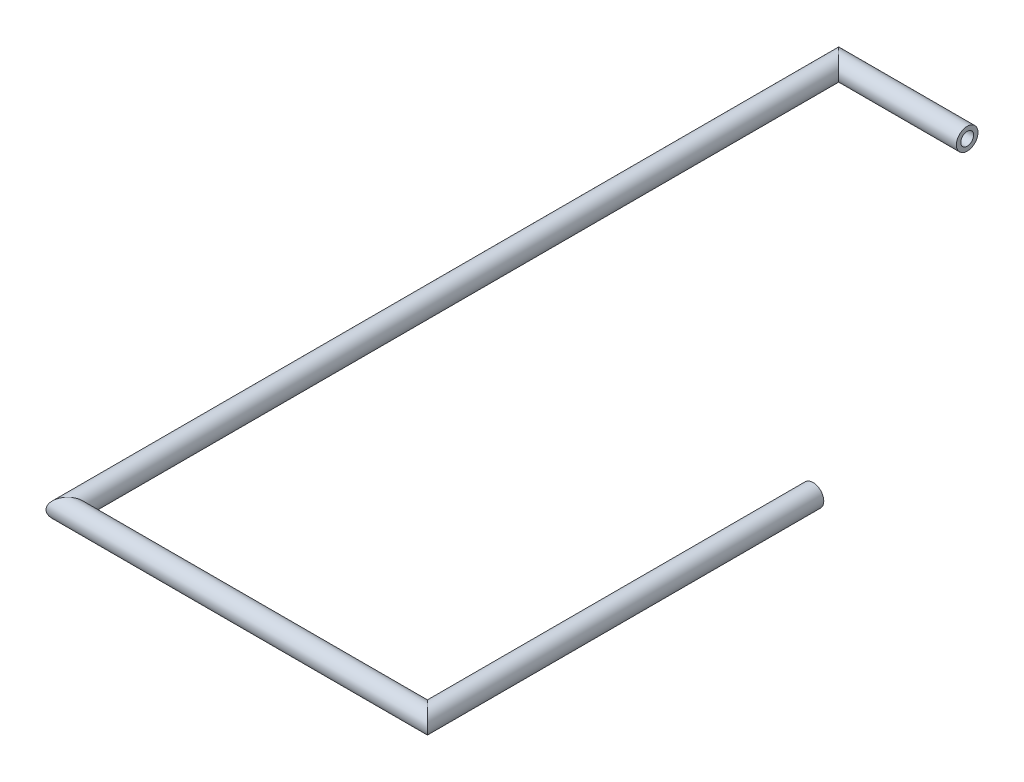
SolidWorks part; units mm, degrees
ref_plane "Front Plane" through (0, 0, 0) normal (0, 0, 1) x (1, 0, 0)
ref_plane "Top Plane" through (0, 0, 0) normal (0, 1, 0) x (1, 0, 0)
ref_plane "Right Plane" through (0, 0, 0) normal (1, 0, 0) x (0, 0, -1)
sketch "Sketch2" plane through (0, 2165.865, 0) normal (0, 1, 0) x (1, 0, 0)
  line L0 (0, 0) -> (0, -381)
  line L1 (0, -381) -> (-355.6, -381)
  line L2 (-355.6, -381) -> (-355.6, 381)
  line L3 (-355.6, 381) -> (-228.6, 381)
  point P2 (398.0429, 151.297)
  point P3 (0, 0)
  point P4 (0, 0)
  point P5 (0, 0)
  point P8 (0, 0)
  point P12 (0, 0)
  point P13 (0, 0)
  point P14 (0, 0)
  point P15 (969.2528, -1732.4212)
  point P16 (0, 0)
  point P18 (0, 0)
  point P19 (-1342.0939, 1192.081)
  dimension "D1" = 762
  dimension "D2" = 355.6
  dimension "D3" = 381
  dimension "D4" = 127
sketch "Sketch3" plane through (0, 0, 0) normal (0, 0, 1) x (1, 0, 0)
  circle A0 centre (0, 2165.865) radius 6.35
  circle A1 centre (0, 2165.865) radius 10.668
  dimension "D1" = 21.336
  dimension "D2" = 12.7
sweep "Sweep1" add profiles "Sketch3" path "Sketch2"
